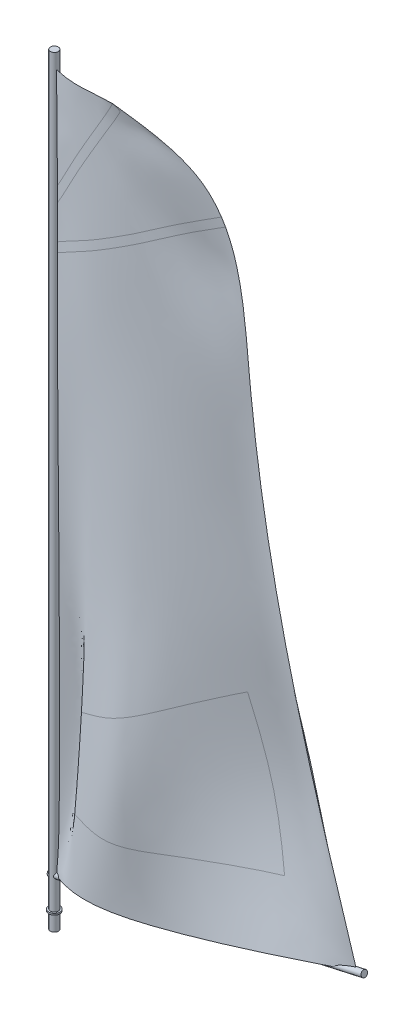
SolidWorks part; units mm, degrees
ref_plane "Plan de face" through (0, 0, 0) normal (0, 0, 1) x (1, 0, 0)
ref_plane "Plan de dessus" through (0, 0, 0) normal (0, 1, 0) x (1, 0, 0)
ref_plane "Plan de droite" through (0, 0, 0) normal (1, 0, 0) x (0, 0, -1)
sketch "Esquisse5" plane through (0, 0, 0) normal (0, 0, 1) x (1, 0, 0)
  line L0 (0, 0) -> (1952.592, 432.8792)
  line L1 (0, 0) -> (0, 4400)
  line L2 (1952.592, 432.8792) -> (1086.9185, 4142.6039)
  line L3 (484.0946, 4515.3607) -> (0, 4400)
  line L4 (0, 0) -> (3397.5594, 0) construction
  arc A0 (1086.9185, 4142.6039) -> (484.0946, 4515.3607) centre (600, 4028.9802) ccw
  point P7 (972.7609, 4631.8108)
  point P8 (1293.7931, 3256.0716)
  point P10 (1477.0384, 2470.7991)
  point P11 (1705.3004, 1492.6135)
  dimension "D1" = 1000
  dimension "D4" = 500
  dimension "D2" = 4400
  dimension "D3" = 2000
  dimension "D5" = 12.5
  dimension "D6" = 600
sketch "Esquisse2" plane through (0, 0, 0) normal (0, 1, 0) x (1, 0, 0)
  line L0 (0, 79.4639) -> (0, -146.124) construction
  circle A0 centre (0, 0) radius 25
  dimension "D1" = 50
sketch "Esquisse3" plane through (0, 0, 0) normal (0, 0, 1) x (1, 0, 0)
  point P0 (471.5366, 1149.4374)
extrude "Extrusion1" add sketch "Esquisse2" along normal blind 4500 and the other way blind 300
ref_plane "Plan8" [suppressed] through (93.4427, 39.987, -421.4363) normal (0.2155, 0.0922, -0.9721) x (-0.9765, 0.0204, -0.2146)
sketch "Esquisse16" plane through (0, 0, 0) normal (0, 0, 1) x (1, 0, 0)
  line L0 (0, 0) -> (1952.592, 432.8792) construction
  point P0 (610.7393, 135.3977)
ref_plane "Plan10" through (0, 0, 0) normal (-0.9763, -0.2164, 0) x (0.2164, -0.9763, 0)
ref_plane "Plan11" through (1952.592, 432.8792, 0) normal (-0.9763, -0.2164, 0) x (0, 0, 1)
sketch "Esquisse17" plane through (1957.3899, 411.2373, 0) normal (-0.9763, -0.2164, 0) x (0, 0, -1)
  circle A0 centre (0, -22.1674) radius 20
  dimension "D1" = 40
extrude "Extrusion3" add sketch "Esquisse17" along normal blind 2025
sketch "Esquisse21" plane through (0, 0, 0) normal (0, 0, 1) x (1, 0, 0)
  line L0 (711.7814, 177.5723) -> (1032.9888, 177.5723) construction
  line L1 (877.5817, 177.5723) -> (791.9449, 177.5723)
  line L2 (791.9449, 177.5723) -> (791.9449, 143.0665)
  line L3 (791.9449, 143.0665) -> (877.5817, 143.0665)
  line L4 (877.5817, 143.0665) -> (877.5817, 177.5723)
ref_plane "Plan9" through (781.0368, 173.1517, 0) normal (-0.9763, -0.2164, 0) x (0, 0, 1)
sketch "Esquisse22" plane through (781.0368, 173.1517, 0) normal (-0.9763, -0.2164, 0) x (0, 0, 1)
  circle A0 centre (4.292, -17.4665) radius 26.3658
extrude "Extrusion4" add sketch "Esquisse22" along normal up to vertex (66.657 mm away)
sketch "Esquisse23" plane through (0, 0, 0) normal (0, 0, 1) x (1, 0, 0)
  point P0 (758.9806, 160.1924)
ref_plane "Plan12" through (0, 0, 0) normal (0.2164, -0.9763, 0) x (0.9763, 0.2164, 0)
sketch "Esquisse24" plane through (0, 0, 0) normal (0.2164, -0.9763, 0) x (0.9763, 0.2164, 0)
  line L0 (1952.2099, 0) -> (1952.0474, -0.9867) construction
  line L1 (0, 0) -> (0.4144, -0.9101) construction
  spline S0 degree 3 poles (0, 0) (63.3716, 28.8548) (324.7897, 147.8857) (1005.4085, 155.9063) (1585.1588, 60.4409) (1952.2099, 0) knots 0 0 0 0 0.105062 0.433397 1 1 1 1
  spline S1 degree 1 poles (0.4144, -0.9101) (1952.0474, -0.9867) knots 0 0 1 1 construction
  spline S2 degree 3 poles (0.4144, -0.9101) (19.2531, 7.6677) (56.9624, 24.838) (113.7916, 49.499) (161.6597, 68.266) (200.4128, 81.6578) (239.5156, 93.8437) (289.001, 106.9406) (349.2386, 119.4983) (410.2106, 129.1718) (492.3263, 138.5841) (596.2072, 144.4929) (721.8837, 144.3755) (847.6078, 139.2431) (972.4561, 131.1825) (1096.5555, 120.4573) (1219.9921, 107.4168) (1342.8636, 92.3872) (1506.0623, 70.1392) (1709.1297, 39.0136) (1871.0554, 12.3499) (1952.0474, -0.9867) knots 0 0 0 0 0.03125 0.0625 0.09375 0.109375 0.125 0.15625 0.1875 0.21875 0.25 0.3125 0.375 0.4375 0.5 0.5625 0.625 0.6875 0.75 0.875 1 1 1 1 construction
  dimension "D1" = 1
ref_plane "Plan13" through (-649.3188, 2928.888, 0) normal (0.2164, -0.9763, 0) x (0.9763, 0.2164, 0)
sketch "Esquisse25" plane through (-649.3188, 2928.888, 0) normal (0.2164, -0.9763, 0) x (0.9763, 0.2164, 0)
  line L3 (665.084, 0) -> (1966.7468, 0) construction
  line L6 (1966.7468, 40) -> (1966.6507, 39.0046) construction
  line L7 (665.084, 0) -> (665.3137, -0.9733) construction
  spline S0 degree 3 poles (665.084, 0) (761.6565, 22.7888) (1014.8795, 82.5433) (1454.9893, 89.4147) (1790.7784, 56.9913) (1966.7468, 40) knots 0 0 0 0 0.226855 0.594838 1 1 1 1
  spline S1 degree 1 poles (665.3137, -0.9733) (1966.6507, 39.0046) knots 0 0 1 1 construction
  spline S2 degree 3 poles (665.3137, -0.9733) (691.9136, 5.3037) (745.1315, 17.8617) (825.0847, 35.6767) (891.9672, 48.8264) (945.6994, 57.8267) (999.6145, 65.6236) (1067.3407, 73.1407) (1149.0098, 78.9952) (1230.9527, 82.0509) (1313.0414, 82.6853) (1395.1542, 81.2683) (1504.4796, 77.1644) (1640.7159, 68.631) (1803.7866, 54.7302) (1912.3607, 44.2468) (1966.6507, 39.0046) knots 0 0 0 0 0.0625 0.125 0.1875 0.21875 0.25 0.3125 0.375 0.4375 0.5 0.5625 0.625 0.75 0.875 1 1 1 1 construction
  dimension "D1" = 40
  dimension "D2" = 1
ref_plane "Plan14" through (-865.7585, 3905.184, 0) normal (0.2164, -0.9763, 0) x (0.9763, 0.2164, 0)
sketch "Esquisse26" plane through (-865.7585, 3905.184, 0) normal (0.2164, -0.9763, 0) x (0.9763, 0.2164, 0)
  line L0 (0, 0) -> (2000, 0) construction
  line L8 (886.7787, 0) -> (1917.6263, 0) construction
  line L11 (886.7787, 0) -> (887.085, -0.9519) construction
  line L12 (1917.6263, 80) -> (1917.5729, 79.0014) construction
  spline S0 degree 3 poles (886.7787, 0) (953.9662, 21.6205) (1114.2715, 73.2057) (1462.5463, 104.3446) (1738.824, 89.5651) (1917.6263, 80) knots 0 0 0 0 0.202914 0.484139 1 1 1 1
  spline S1 degree 1 poles (887.085, -0.9519) (1917.5729, 79.0014) knots 0 0 1 1 construction
  spline S2 degree 3 poles (887.085, -0.9519) (907.7715, 5.7049) (949.1668, 19.0262) (1011.4771, 37.8681) (1063.8169, 51.7038) (1106.0679, 61.063) (1148.5889, 69.2256) (1202.169, 77.3874) (1288.5629, 86.71) (1397.2811, 92.6342) (1527.491, 94.2013) (1657.5894, 91.4896) (1787.5961, 85.955) (1874.25, 81.319) (1917.5729, 79.0014) knots 0 0 0 0 0.0625 0.125 0.1875 0.21875 0.25 0.3125 0.375 0.5 0.625 0.75 0.875 1 1 1 1 construction
  dimension "D1" = 80
  dimension "D2" = 1
ref_plane "Plan15" through (-929.6081, 4193.1914, 0) normal (0.2164, -0.9763, 0) x (0.9763, 0.2164, 0)
sketch "Esquisse27" plane through (-929.6081, 4193.1914, 0) normal (0.2164, -0.9763, 0) x (0.9763, 0.2164, 0)
  line L0 (952.1786, 0) -> (2401.2183, 0) construction
  line L3 (1449.9225, 120) -> (1450.103, 119.0164) construction
  line L4 (952.1786, 0) -> (952.5363, -0.9338) construction
  spline S0 degree 3 poles (952.1786, 0) (1008.1752, 21.4481) (1123.2079, 65.5084) (1293.0954, 91.2242) (1402.4876, 111.2963) (1449.9225, 120) knots 0 0 0 0 0.349474 0.717917 1 1 1 1
  spline S1 degree 1 poles (952.5363, -0.9338) (1450.103, 119.0164) knots 0 0 1 1 construction
  spline S2 degree 3 poles (952.5363, -0.9338) (972.5521, 6.7327) (1012.6206, 22.081) (1063.0311, 39.8541) (1103.8013, 52.4176) (1134.6593, 60.7686) (1165.8241, 68.0152) (1207.6831, 76.5704) (1249.8789, 83.9029) (1292.1571, 90.9202) (1334.3952, 98.068) (1387.0422, 107.4484) (1429.0795, 115.1589) (1450.103, 119.0164) knots 0 0 0 0 0.125 0.25 0.3125 0.375 0.4375 0.5 0.625 0.6875 0.75 0.875 1 1 1 1 construction
  dimension "D1" = 120
  dimension "D2" = 1
curve "Courbe2"
curve "Courbe3"
curve "Courbe4"
curve "Courbe6"
surface "Surface-Lissage6"
sketch "Esquisse28" plane through (0, 0, 0) normal (0, 0, 1) x (1, 0, 0)
  line L0 (0, 3733.1767) -> (485.9454, 4507.012)
  line L1 (0, 3639.1576) -> (528.2887, 4480.4217)
  line L2 (528.2887, 4480.4217) -> (485.9454, 4507.012)
  line L3 (0, 3733.1767) -> (0, 3639.1576)
  line L7 (0, 4500) -> (0, -300) construction
  dimension "D1" = 50
sketch "Esquisse29" plane through (0, 0, 0) normal (0, 0, 1) x (1, 0, 0)
  line L0 (0, 3448.0066) -> (1220.5499, 4244.2825)
  line L1 (1220.5499, 4244.2825) -> (1247.8696, 4202.4062)
  line L2 (1247.8696, 4202.4062) -> (0, 3388.307)
  line L3 (0, 3388.307) -> (0, 3448.0066)
  line L5 (0, 4500) -> (0, -300) construction
  dimension "D1" = 50
sketch "Esquisse30" plane through (0, 0, 0) normal (0, 0, 1) x (1, 0, 0)
  line L0 (184.2708, 453.625) -> (1442.7946, 708.4181)
  line L1 (1442.7946, 708.4181) -> (1203.4434, 1588.6127)
  line L2 (1203.4434, 1588.6127) -> (184.2708, 1001.8163)
  line L3 (184.2708, 1001.8163) -> (184.2708, 453.625)
sketch "Esquisse31" plane through (0, 0, 0) normal (0, 0, 1) x (1, 0, 0)
  point P0 (414.706, 1935.823)
ref_plane "Plan16" through (0, -200, 0) normal (0, 1, 0) x (1, 0, 0)
sketch "Esquisse32" plane through (0, -200, 0) normal (0, 1, 0) x (1, 0, 0)
  circle A0 centre (0, 0) radius 35
  dimension "D1" = 70
extrude "Boss.-Extru.1" add sketch "Esquisse32" along normal blind 10
